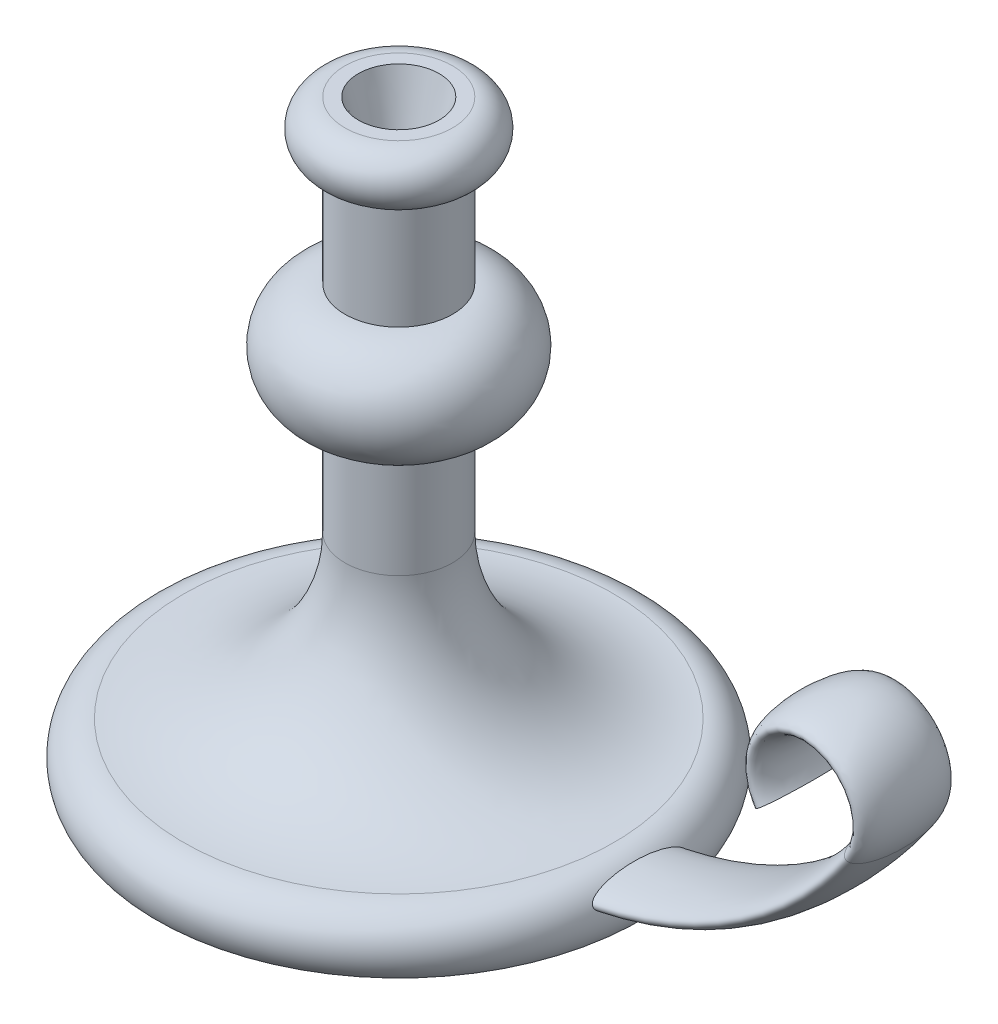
SolidWorks part; units mm, degrees
ref_plane "Front" through (0, 0, 0) normal (0, 0, 1) x (1, 0, 0)
ref_plane "Top" through (0, 0, 0) normal (0, 1, 0) x (1, 0, 0)
ref_plane "Right" through (0, 0, 0) normal (1, 0, 0) x (0, 0, -1)
sketch "Sketch1" plane through (0, 0, 0) normal (0, 0, 1) x (1, 0, 0)
  line L0 (0, 220) -> (0, 0) construction
  line L1 (0, 0) -> (90, 0)
  line L2 (0, 220) -> (20, 220)
  line L3 (20, 200) -> (20, 160)
  line L4 (20, 120) -> (20, 80)
  line L6 (0, 220) -> (0, 0)
  arc A0 (20, 220) -> (20, 200) centre (20, 210) cw
  arc A1 (20, 160) -> (20, 120) centre (20, 140) cw
  arc A2 (20, 80) -> (80, 20) centre (80, 80) ccw
  arc A3 (80, 20) -> (90, 0) centre (80, 7.5) cw
  dimension "D4" = 10
  dimension "D5" = 20
  dimension "D9" = 60
  dimension "D10" = 12.5
  dimension "D1" = 90
  dimension "D2" = 20
  dimension "D3" = 220
  dimension "D6" = 40
  dimension "D7" = 20
  dimension "D8" = 40
revolve "Base-Revolve" add sketch "Sketch1" angle 360 about L0
sketch "Sketch2" plane through (0, 0, 0) normal (0, 0, 1) x (1, 0, 0)
  line L0 (0, 10) -> (60, 10)
  line L1 (0, 220) -> (0, 0) construction
  line L2 (-90, 0) -> (90, 0) construction
  arc A0 (60, 10) -> (183.5921, 75) centre (60, 160) ccw
  arc A1 (183.5921, 75) -> (150.6342, 75) centre (167.1131, 86.3333) ccw
  dimension "D2" = 150
  dimension "D4" = 20
  dimension "D1" = 60
  dimension "D3" = 65
  dimension "D5" = 10
sketch "Sketch3" plane through (0, 0, 0) normal (1, 0, 0) x (0, 0, -1)
  ellipse E0 centre (0, 10) end of major axis (17.5, 10) minor radius 5
  dimension "D1" = 10
  dimension "D2" = 35
sweep "Boss-Sweep1" add profiles "Sketch3" path "Sketch2"
sketch "Sketch4" plane through (0, 220, 0) normal (0, 1, 0) x (-1, 0, 0)
  circle A0 centre (0, 0) radius 15
  dimension "D1" = 30
extrude "Cut-Extrude1" cut sketch "Sketch4" against normal blind 25 draft 15
